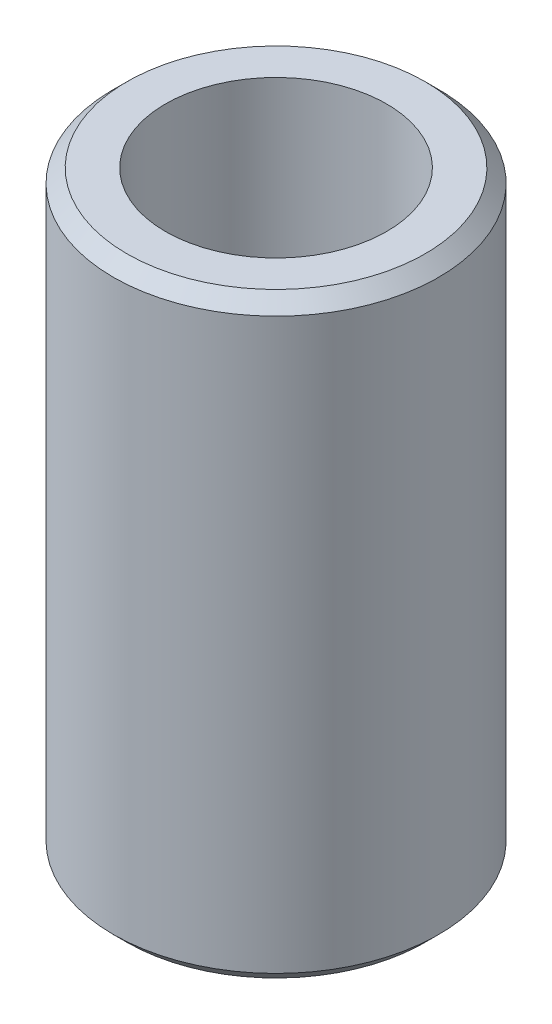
SolidWorks part; units mm, degrees
ref_plane "Front Plane" through (0, 0, 0) normal (0, 0, 1) x (1, 0, 0)
ref_plane "Top Plane" through (0, 0, 0) normal (0, 1, 0) x (1, 0, 0)
ref_plane "Right Plane" through (0, 0, 0) normal (1, 0, 0) x (0, 0, -1)
sketch "Sketch1" plane through (0, 0, 0) normal (0, 1, 0) x (1, 0, 0)
  circle A0 centre (0, 0) radius 9.5275
  dimension "D1" = 19.0551
extrude "Extrude1" add sketch "Sketch1" along normal mid plane 34.925
chamfer "Chamfer1" distance 0.7937 angle 45 2 edges at (0, -17.4625, 9.5275) (0, 17.4625, 9.5275)
sketch "Sketch2" plane through (0, 17.4625, 0) normal (0, 1, 0) x (1, 0, 0)
  circle A0 centre (0, 0) radius 6.477
  circle A1 centre (0, 0) radius 8.7338 construction
  dimension "D1" = 12.954
extrude "Extrude2" cut sketch "Sketch2" against normal through all
